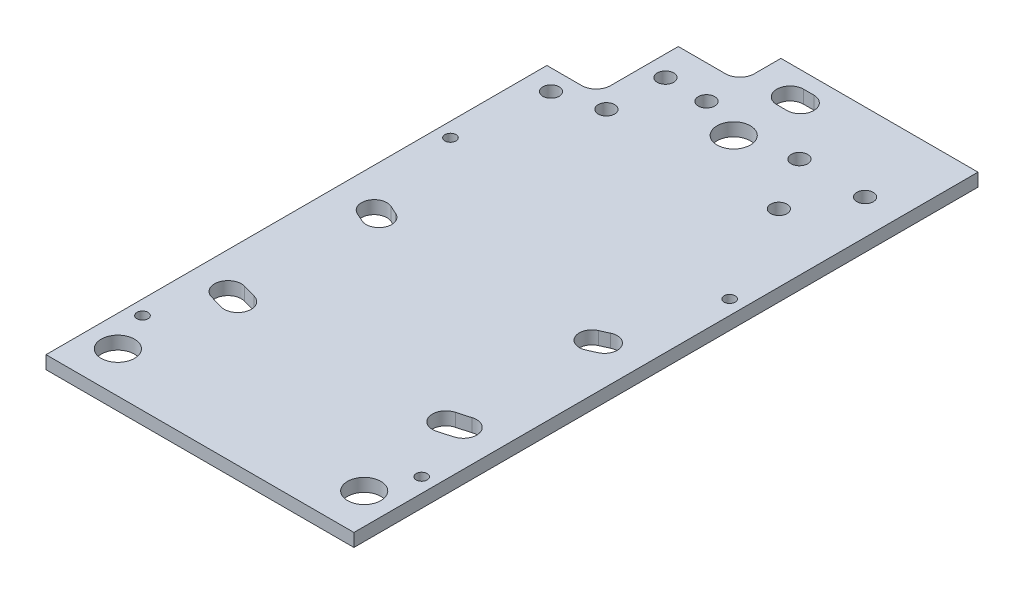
SolidWorks part; units mm, degrees
ref_plane "Front Plane" through (0, 0, 0) normal (0, 0, 1) x (1, 0, 0)
ref_plane "Top Plane" through (0, 0, 0) normal (0, 1, 0) x (1, 0, 0)
ref_plane "Right Plane" through (0, 0, 0) normal (1, 0, 0) x (0, 0, -1)
sketch "Sketch1" plane through (0, 0, 0) normal (0, 1, 0) x (1, 0, 0)
  line L1 (-37.5, 76) -> (37.5, 76)
  line L2 (-37.5, 76) -> (-37.5, -76)
  line L3 (-37.5, -76) -> (37.5, -76)
  line L4 (37.5, 76) -> (37.5, -76)
  line L5 (-37.5, 76) -> (37.5, -76) construction
  line L6 (-37.5, -76) -> (37.5, 76) construction
  point P0 (0, 0)
  dimension "D1" = 152
  dimension "D2" = 75
extrude "Plate Extrude" add sketch "Sketch1" along normal blind 3.175
sketch "Sketch4" plane through (0, 3.175, 0) normal (0, 1, 0) x (1, 0, 0)
  line L0 (0, 0) -> (0, 54) construction
  line L1 (-30, -66) -> (30, -66) construction
  line L2 (-37.5, -76) -> (37.5, -76) construction
  circle A0 centre (0, 54) radius 4.0625
  circle A1 centre (30, -66) radius 4.0625
  circle A2 centre (-30, -66) radius 4.0625
  dimension "D4" = 8.125
  dimension "D2" = 120
  dimension "D1" = 10
  dimension "D3" = 60
extrude "KM Holes" cut sketch "Sketch4" against normal through all
hole_wizard "Collar Mount #6-32 Tapped Hole1" positions "Sketch10" profile "Sketch11" tap size "#6-32" standard "ANSI Inch"
sketch "Sketch10" plane through (0, 3.175, 0) normal (0, 1, 0) x (1, 0, 0)
  line L0 (0, 0) -> (0, -71.8631) construction
  line L4 (-37.5, -76) -> (37.5, -76) construction
  point P0 (-34, 19)
  point P3 (34, 19)
  point P6 (-34, -56)
  point P9 (34, -56)
  dimension "D1" = 68
  dimension "D2" = 75
  dimension "D3" = 20
sketch "Sketch11" plane through (-34, 3.175, -19) normal (1, 0, 0) x (0, 0, 1)
  line L0 (0, 0) -> (0, 3.175)
  line L1 (0, 3.175) -> (1.3525, 3.175)
  line L2 (1.3525, 3.175) -> (1.3525, 0)
  line L5 (1.3525, 0) -> (0, 0)
  line L11 (0, -6.35) -> (0, 107.95) construction
  dimension "Thru Tap Drill Dia." = 2.7051
  dimension "Thru Tap Drill Depth" = 3.175
sketch "Sketch7" plane through (0, 3.175, 0) normal (0, 1, 0) x (1, 0, 0)
  line L0 (-27, -41) -> (27, -41) construction
  line L1 (-1.25, 69) -> (1.25, 69) construction
  line L2 (-1.25, 72.26) -> (1.25, 72.26)
  line L3 (0, 54) -> (25.3379, -41.4567) construction
  line L4 (0, 54) -> (28.6539, -40.5143) construction
  line L5 (0, 54) -> (0, -6) construction
  line L6 (0, -6) -> (0, -66) construction
  line L7 (-1.25, 65.74) -> (1.25, 65.74)
  line L8 (-30, -66) -> (30, -66) construction
  arc A0 (-28.6539, -40.5143) -> (-25.3379, -41.4567) centre (0, 54) ccw construction
  arc A1 (-29.6008, -43.6378) -> (-26.1753, -44.6114) centre (0, 54) ccw
  arc A2 (-27.7069, -37.3908) -> (-24.5005, -38.3021) centre (0, 54) ccw
  arc A3 (-27.7069, -37.3908) -> (-29.6008, -43.6378) centre (-28.6539, -40.5143) ccw
  arc A4 (-26.1753, -44.6114) -> (-24.5005, -38.3021) centre (-25.3379, -41.4567) ccw
  arc A5 (25.3379, -41.4567) -> (28.6539, -40.5143) centre (0, 54) ccw construction
  arc A6 (26.1753, -44.6114) -> (29.6008, -43.6378) centre (0, 54) ccw
  arc A7 (24.5005, -38.3021) -> (27.7069, -37.3908) centre (0, 54) ccw
  arc A8 (24.5005, -38.3021) -> (26.1753, -44.6114) centre (25.3379, -41.4567) ccw
  arc A9 (29.6008, -43.6378) -> (27.7069, -37.3908) centre (28.6539, -40.5143) ccw
  arc A11 (-1.25, 72.26) -> (-1.25, 65.74) centre (-1.25, 69) ccw
  arc A12 (1.25, 65.74) -> (1.25, 72.26) centre (1.25, 69) ccw
  point P4 (-27, -41)
  point P9 (27, -41)
  point P28 (0, 69)
  dimension "D2" = 3.2639
  dimension "D4" = 25
  dimension "D5" = 3.26
  dimension "D1" = 2
  dimension "D3" = 54
  dimension "D6" = 15
  dimension "D7" = 2.5
extrude "Bolt Holes" cut sketch "Sketch7" against normal through all
sketch "Sketch18" plane through (0, 3.175, 0) normal (0, 1, 0) x (1, 0, 0)
  line L0 (0, 0) -> (0, -32.7086) construction
  line L1 (0, 54) -> (25.9487, -6.4621) construction
  line L2 (0, 54) -> (28.043, -5.5196) construction
  line L3 (27, -6) -> (-27, -6) construction
  arc A0 (-28.043, -5.5196) -> (-25.9487, -6.4621) centre (0, 54) ccw construction
  arc A1 (-29.3643, -8.324) -> (-27.1713, -9.3108) centre (0, 54) ccw
  arc A2 (-26.7218, -2.7153) -> (-24.7261, -3.6133) centre (0, 54) ccw
  arc A3 (-26.7218, -2.7153) -> (-29.3643, -8.324) centre (-28.043, -5.5196) ccw
  arc A4 (-27.1713, -9.3108) -> (-24.7261, -3.6133) centre (-25.9487, -6.4621) ccw
  arc A5 (25.9487, -6.4621) -> (28.043, -5.5196) centre (0, 54) ccw construction
  arc A6 (27.1713, -9.3108) -> (29.3643, -8.324) centre (0, 54) ccw
  arc A7 (24.7261, -3.6133) -> (26.7218, -2.7153) centre (0, 54) ccw
  arc A8 (24.7261, -3.6133) -> (27.1713, -9.3108) centre (25.9487, -6.4621) ccw
  arc A9 (29.3643, -8.324) -> (26.7218, -2.7153) centre (28.043, -5.5196) ccw
  point P4 (-27, -6)
  point P12 (27, -6)
  dimension "D4" = 3.1
  dimension "D1" = 54
  dimension "D2" = 2
  dimension "D3" = 60
extrude "KM Spring Holes" cut sketch "Sketch18" against normal through all
hole_wizard "#2-56 Tapped Hole1" positions "Sketch13" profile "Sketch14" tap size "#2-56" standard "ANSI Inch"
sketch "Sketch13" plane through (0, 3.175, 0) normal (0, 1, 0) x (1, 0, 0)
  line L0 (0, 0) -> (0, 87.5) construction
  line L1 (37.5, 87.5) -> (-37.5, 87.5) construction
  point P0 (-19.8329, 81.5)
  point P3 (19.8329, 81.5)
  dimension "D1" = 6
sketch "Sketch14" plane through (-19.8329, 3.175, -81.5) normal (1, 0, 0) x (0, 0, 1)
  line L0 (0, 0) -> (0, 3.175)
  line L1 (0, 3.175) -> (0.889, 3.175)
  line L2 (0.889, 3.175) -> (0.889, 0)
  line L5 (0.889, 0) -> (0, 0)
  line L11 (0, -6.35) -> (0, 107.95) construction
  dimension "Thru Tap Drill Dia." = 1.778
  dimension "Thru Tap Drill Depth" = 3.175
sketch "Sketch6" plane through (0, 3.175, 0) normal (0, 1, 0) x (1, 0, 0)
  line L0 (0, 54) -> (0, 1) construction
  line L1 (-37.5, 1) -> (37.5, 1) construction
  line L2 (-37.5, 76) -> (-37.5, -76) construction
  line L3 (37.5, -76) -> (37.5, 76) construction
  circle A0 centre (37.5, 1) radius 5
  circle A1 centre (-37.5, 1) radius 5
  dimension "D2" = 10
  dimension "D1" = 53
extrude "Indent Sides" [suppressed] cut sketch "Sketch6" against normal through all
sketch "Sketch16" [suppressed] plane through (0, 3.175, 0) normal (0, 1, 0) x (1, 0, 0)
  line L0 (-36.3, 19.25) -> (-36.3, 98.25)
  line L1 (41.3, 98.25) -> (-41.3, 98.25) construction
  line L2 (36.3, 19.25) -> (36.3, 98.25)
  line L3 (36.3, 98.25) -> (41.3, 98.25)
  line L4 (41.3, 98.25) -> (41.3, 24.25)
  line L5 (41.3, 24.25) -> (36.3, 19.25)
  line L6 (-36.3, 98.25) -> (-41.3, 98.25)
  line L7 (-41.3, 98.25) -> (-41.3, 24.25)
  line L8 (-41.3, 24.25) -> (-36.3, 19.25)
  arc A0 (-41.3, 14.25) -> (-41.3, 24.25) centre (-41.3, 19.25) ccw construction
  arc A1 (41.3, 24.25) -> (41.3, 14.25) centre (41.3, 19.25) ccw construction
extrude "Remove Side Portion" [suppressed] cut sketch "Sketch16" against normal through all
sketch "Sketch19" plane through (0, 3.175, 0) normal (0, 1, 0) x (1, 0, 0)
  line L0 (37.5, 76) -> (-37.5, 76) construction
  line L1 (-37.5, 76) -> (-25.5, 76)
  line L2 (-37.5, 76) -> (-37.5, 46)
  line L3 (-34, 46) -> (-29, 46)
  line L4 (-25.5, 66) -> (-25.5, 49.5)
  line L5 (-31.5, 76) -> (-31.5, 46) construction
  line L6 (-25.5, 66) -> (-10.5, 66)
  line L7 (-37.5, 76) -> (-37.5, -76) construction
  line L8 (-34, 46) -> (-37.5, 46)
  line L9 (-10.5, 66) -> (-10.5, 76)
  line L10 (-10.5, 76) -> (-25.5, 76)
  circle A0 centre (-31.5, 41) radius 2
  arc A1 (-29, 46) -> (-25.5, 49.5) centre (-29, 49.5) ccw
  dimension "D3" = 4
  dimension "D5" = 3.5
  dimension "D1" = 12
  dimension "D2" = 30
  dimension "D4" = 5
  dimension "D6" = 15
  dimension "D7" = 10
extrude "Spring Slot and Hole" cut sketch "Sketch19" against normal up to next
sketch "Sketch20" plane through (0, 3.175, 0) normal (0, 1, 0) x (1, 0, 0)
  line L0 (0, 0) -> (0, 31.5391) construction
  circle A0 centre (-21, 44) radius 2
  circle A1 centre (21, 44) radius 2
  circle A2 centre (-34, 19) radius 1.3525 construction
  dimension "D1" = 4
  dimension "D2" = 25
  dimension "D3" = 42
extrude "Vectran Holes" cut sketch "Sketch20" against normal up to next
sketch "Sketch21" plane through (0, 3.175, 0) normal (0, 1, 0) x (1, 0, 0)
  line L0 (21, 44) -> (21, 57.7368) construction
  circle A0 centre (29, 57) radius 2
  circle A1 centre (13, 57) radius 2
  dimension "D1" = 4
  dimension "D2" = 13
  dimension "D3" = 16
extrude "Burn Mechanism" cut sketch "Sketch21" against normal up to next
fillet "Fillet1" radius 3.5 1 edges at (-10.5, 1.5875, -66)
sketch "Sketch23" plane through (0, 3.175, 0) normal (0, 1, 0) x (1, 0, 0)
  line L0 (-25.5, 66) -> (-14, 66) construction
  line L1 (-25.5, 49.5) -> (-25.5, 66) construction
  circle A0 centre (-20.5, 57.875) radius 2
  circle A1 centre (-10.5, 57.875) radius 2
  dimension "D4" = 4
  dimension "D1" = 8.125
  dimension "D2" = 5
  dimension "D3" = 10
extrude "Cut-Extrude2" cut sketch "Sketch23" against normal up to next
